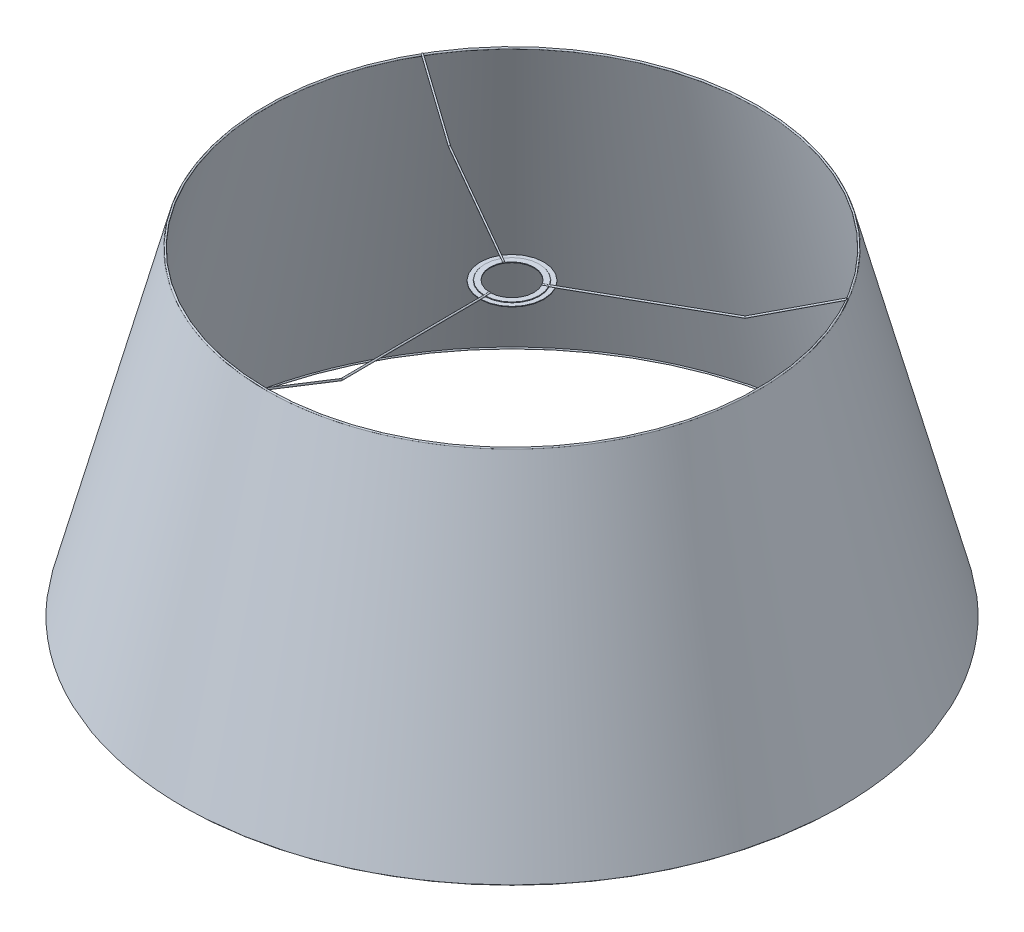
SolidWorks part; units mm, degrees
ref_plane "Alzado" through (0, 0, 0) normal (0, 0, 1) x (1, 0, 0)
ref_plane "Planta" through (0, 0, 0) normal (0, 1, 0) x (1, 0, 0)
ref_plane "Vista lateral" through (0, 0, 0) normal (1, 0, 0) x (0, 0, -1)
sketch "Croquis1" plane through (0, 0, 0) normal (0, 1, 0) x (1, 0, 0)
  circle A0 centre (0, 0) radius 300
  dimension "D1" = 600
ref_plane "Plano1" through (0, 290, 0) normal (0, 1, 0) x (1, 0, 0)
sketch "Croquis2" plane through (0, 290, 0) normal (0, 1, 0) x (1, 0, 0)
  circle A0 centre (0, 0) radius 224.105
  dimension "D1" = 448.21
sketch "Croquis3" plane through (0, 0, 0) normal (0, 0, 1) x (1, 0, 0)
  line L0 (-224.105, 290) -> (-300, 0)
loft "Recubrir1" add profiles "Croquis2", "Croquis1"
shell "Vaciado1" thickness 1
sketch "Croquis4" plane through (0, 289, 0) normal (0, -1, 0) x (1, 0, 0)
  spline S1 degree 3 number of poles 193 (0, -223.333) -> (0, -223.333)
  spline S2 degree 3 number of poles 193 (0, -223.333) -> (0, -223.333)
  dimension "D1" = 0
extrude "Cortar-Extruir1" cut sketch "Croquis4" against normal blind 10
sketch "Croquis5" plane through (0, 0, 0) normal (0, 0, 1) x (1, 0, 0)
  line L0 (0, 0) -> (0, 149.2278) construction
  circle A0 centre (223.333, 290) radius 0.75
  circle A1 centre (298.996, 0) radius 0.75
  dimension "D1" = 1.5
revolve "Revolución1" add sketch "Croquis5" angle 360 about L0
ref_plane "Plano2" through (0, 264, 0) normal (0, 1, 0) x (1, 0, 0)
sketch "Croquis6" plane through (0, 264, 0) normal (0, 1, 0) x (1, 0, 0)
  circle A0 centre (0, 0) radius 29
  circle A1 centre (0, 0) radius 20
  dimension "D1" = 58
  dimension "D2" = 40
extrude "Saliente-Extruir1" add sketch "Croquis6" along normal blind 0.5 separate body
sketch "Croquis7" plane through (0, 264.5, 0) normal (0, 1, 0) x (1, 0, 0)
  circle A0 centre (0, 0) radius 20 construction
  circle A1 centre (0, 0) radius 20
  circle A2 centre (0, 0) radius 25
  dimension "D1" = 5
extrude "Saliente-Extruir2" add sketch "Croquis7" along normal blind 0.5
sketch "Croquis8" plane through (0, 264, 0) normal (0, -1, 0) x (1, 0, 0)
  circle A1 centre (0, 0) radius 25
  circle A2 centre (0, 0) radius 25
  circle A3 centre (0, 0) radius 20
  circle A4 centre (0, 0) radius 20
  dimension "D1" = 0
  dimension "D2" = 0
extrude "Cortar-Extruir3" cut sketch "Croquis8" against normal blind 0.4
chamfer "Chaflán1" distance 0.2 angle 45 1 edges at (0, 265, 25)
sketch "Croquis9" plane through (0, 0, 0) normal (0, 0, 1) x (1, 0, 0)
  line L2 (20, 265) -> (-20, 265) construction
  circle A0 centre (0, 265) radius 0.75
  dimension "D1" = 1.5
sketch "Croquis10" plane through (0, 0, 0) normal (1, 0, 0) x (0, 0, -1)
  line L0 (-223.333, 290.75) -> (-155.333, 264)
  line L1 (223.333, 290.75) -> (-223.333, 290.75) construction
  line L2 (351.7177, 264) -> (-351.7177, 264) construction
  line L3 (-155.333, 264) -> (0, 265)
  line L4 (0, 265.75) -> (0, 264.25) construction
  arc A0 (-223.333, 290.75) -> (-224.083, 290) centre (-223.333, 290) ccw construction
  dimension "D1" = 68
sweep "Barrer1" add profiles "Croquis9" path "Croquis10"
pattern_circular "MatrizC1" count 3 over 360 of "Barrer1"
sketch "Croquis11" plane through (0, 265, 0) normal (0, 1, 0) x (1, 0, 0)
  circle A0 centre (0, 0) radius 20
extrude "Cortar-Extruir4" cut sketch "Croquis11" against normal through all both and the other way through all
